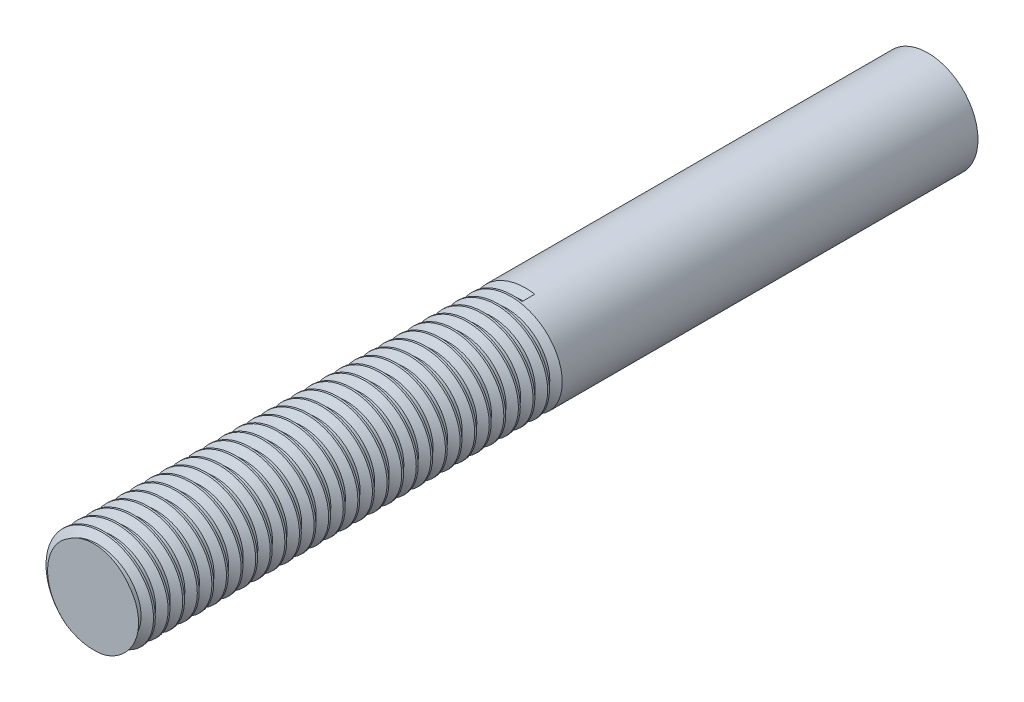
SolidWorks part; units mm, degrees
ref_plane "Ebene vorne" through (0, 0, 0) normal (0, 0, 1) x (1, 0, 0)
ref_plane "Ebene oben" through (0, 0, 0) normal (0, 1, 0) x (1, 0, 0)
ref_plane "Ebene rechts" through (0, 0, 0) normal (1, 0, 0) x (0, 0, -1)
sketch "Skizze1" plane through (0, 0, 0) normal (0, 0, 1) x (1, 0, 0)
  circle A0 centre (0, 0) radius 6
  dimension "D1" = 12
extrude "Aufsatz-Linear austragen1" add sketch "Skizze1" along normal blind 100
thread "Gewinde2" pitch 1.75 start angle 0, offset 3, length 53, pitch 1.75, diameter 12
ref_plane "Ebene2" through (-6, 0, 103) normal (0, -1, 0) x (-1, 0, 0)
sketch "Gewindeprofil2" plane through (-6, 0, 103) normal (0, -1, 0) x (-1, 0, 0)
  line L0 (0, 0) -> (0, 1.75) construction
  line L11 (0, 0) -> (0, 1.5312)
  line L12 (0, 1.5312) -> (-0.9472, 0.9844)
  line L13 (-0.9472, 0.9844) -> (-0.9472, 0.5469)
  line L15 (-0.9472, 0.5469) -> (0, 0)
  line L17 (-0.9472, 0.7656) -> (0, 0.7656) construction
  point P2 (0, 0)
  dimension "Pitch" = 1.75
  dimension "Profile_Angle" = 60
  dimension "Profile_Land" = 0.4375
  dimension "Profile_Height" = 0.9472
thread "Gewinde1" pitch 1.75 start angle 0, offset 0, length 50, pitch 1.75, diameter 12
ref_plane "Ebene1" through (-6, 0, 100) normal (0, -1, 0) x (-1, 0, 0)
sketch "Gewindeprofil1" plane through (-6, 0, 100) normal (0, -1, 0) x (-1, 0, 0)
  line L0 (0, 0) -> (0, 1.75) construction
  line L11 (0, 0) -> (0, 1.5312)
  line L12 (0, 1.5312) -> (-0.9472, 0.9844)
  line L13 (-0.9472, 0.9844) -> (-0.9472, 0.5469)
  line L15 (-0.9472, 0.5469) -> (0, 0)
  line L17 (-0.9472, 0.7656) -> (0, 0.7656) construction
  point P2 (0, 0)
  dimension "Pitch" = 1.75
  dimension "Profile_Angle" = 60
  dimension "Profile_Land" = 0.4375
  dimension "Profile_Height" = 0.9472
